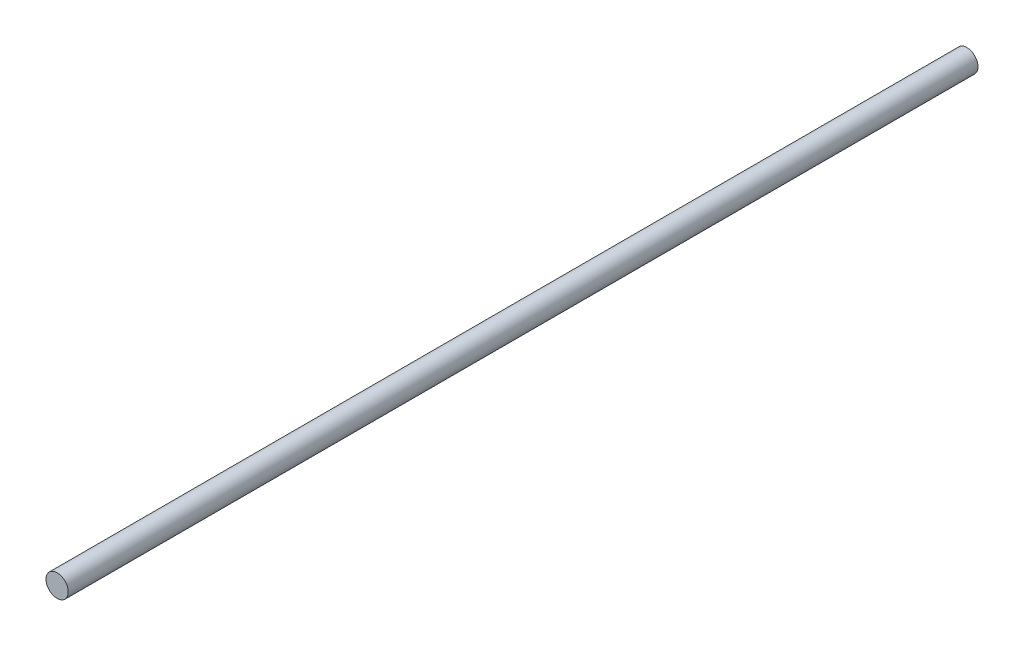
SolidWorks part; units mm, degrees
ref_plane "Front Plane" through (0, 0, 0) normal (0, 0, 1) x (1, 0, 0)
ref_plane "Top Plane" through (0, 0, 0) normal (0, 1, 0) x (1, 0, 0)
ref_plane "Right Plane" through (0, 0, 0) normal (1, 0, 0) x (0, 0, -1)
sketch "Sketch1" plane through (0, 0, 0) normal (0, 0, 1) x (1, 0, 0)
  circle A0 centre (0, 0) radius 30
  dimension "D1" = 60
extrude "Boss-Extrude1" add sketch "Sketch1" against normal blind 2450
